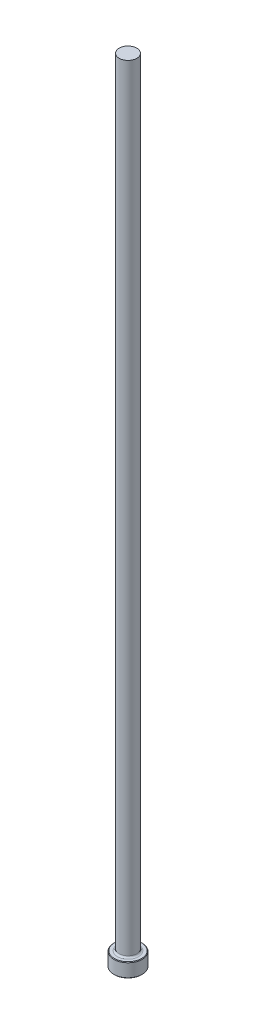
SolidWorks part; units mm, degrees
ref_plane "Front Plane" through (0, 0, 0) normal (0, 0, 1) x (1, 0, 0)
ref_plane "Top Plane" through (0, 0, 0) normal (0, 1, 0) x (1, 0, 0)
ref_plane "Right Plane" through (0, 0, 0) normal (1, 0, 0) x (0, 0, -1)
sketch "Sketch1" plane through (0, 0, 0) normal (0, 0, 1) x (1, 0, 0)
  line L0 (0, 259.9588) -> (0, -15.1925) construction
  line L1 (0, 0) -> (-6.35, 0)
  line L2 (-6.35, 0) -> (-6.35, 6.35)
  line L3 (-6.35, 6.35) -> (-3.9687, 6.35)
  line L4 (-3.9687, 6.35) -> (-3.9687, 355.6)
  line L5 (-3.9687, 355.6) -> (0, 355.6)
  line L6 (0, 355.6) -> (0, 0)
  dimension "L" = 355.6
  dimension "H" = 12.7
  dimension "T" = 6.35
  dimension "D" = 7.9375
revolve "Revolve1" add sketch "Sketch1" angle 360 about L0
chamfer "Chamfer1" distance 0.254 angle 45 2 edges at (0, 6.35, 6.35) (0, 0, 6.35)
fillet "Fillet1" radius 0.762 1 edges at (0, 6.35, 3.9687)
sketch "Pocket Sketch" plane through (0, 0, 0) normal (0, 0, 1) x (1, 0, 0)
  line L0 (-6.7469, 0) -> (-6.7469, 6.3754)
  line L1 (-6.7469, 6.3754) -> (-5.1276, 6.3754)
  line L2 (-4.3656, 7.1374) -> (-4.3656, 22.225)
  line L3 (-4.3656, 22.225) -> (0, 22.225)
  line L4 (0, 22.225) -> (0, 0)
  line L5 (0, 0) -> (-6.7469, 0)
  line L6 (0, 12.6104) -> (0, -2.4989) construction
  line L7 (-6.35, 6.096) -> (-6.35, 0.254) construction
  line L8 (6.096, 6.35) -> (-6.096, 6.35) construction
  line L9 (-3.9687, 355.6) -> (-3.9687, 7.112) construction
  line L10 (-5.1276, 6.3754) -> (-4.3656, 7.1374)
  point P3 (-4.3656, 6.3754)
  dimension "D1" = 13.4937
  dimension "D2" = 0.3969
  dimension "D3" = 0.0254
  dimension "D4" = 0.3969
  dimension "D5" = 8.7312
  dimension "D6" = 22.225
